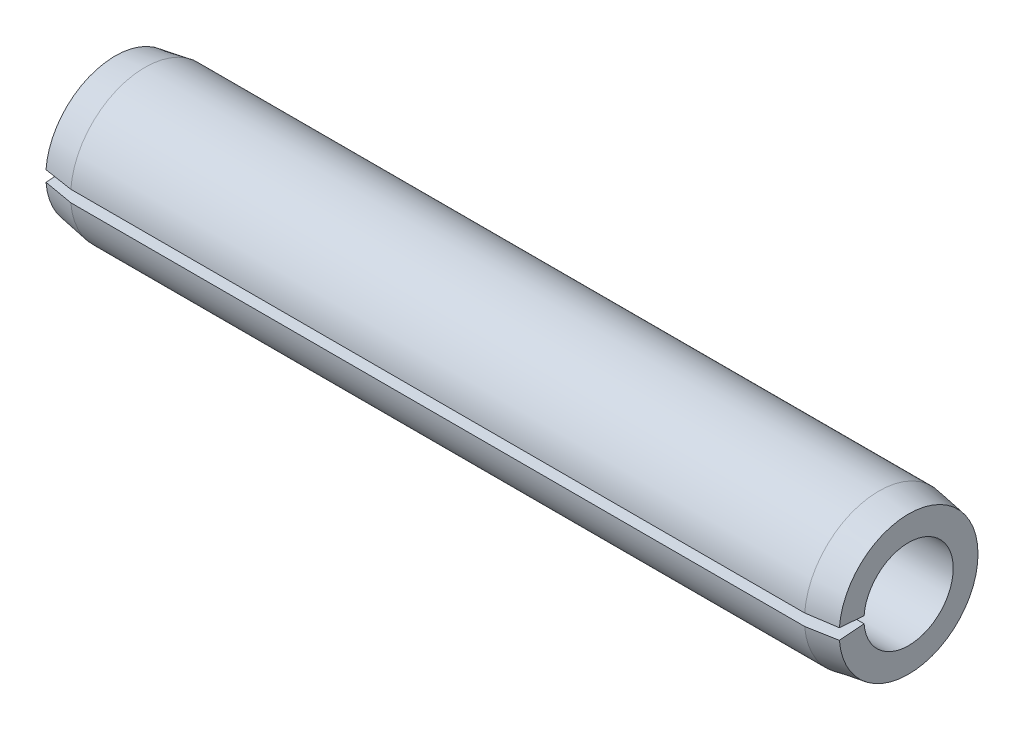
SolidWorks part; units mm, degrees
ref_plane "Plane1" through (0, 0, 0) normal (0, 0, 1) x (1, 0, 0)
ref_plane "Plane2" through (0, 0, 0) normal (0, 1, 0) x (1, 0, 0)
ref_plane "Plane3" through (0, 0, 0) normal (1, 0, 0) x (0, 0, -1)
sketch "Sketch1" plane through (0, 0, 0) normal (0, 0, 1) x (1, 0, 0)
  line L0 (-9.525, 0) -> (111.125, 0) construction
  line L1 (0, 5.715) -> (101.6, 5.715)
  line L2 (101.6, 5.715) -> (101.6, 8.89)
  line L3 (101.6, 8.89) -> (97.79, 9.525)
  line L4 (97.79, 9.525) -> (3.81, 9.525)
  line L5 (3.81, 9.525) -> (0, 8.89)
  line L7 (0, 8.89) -> (0, 5.715)
  dimension "Diameter" = 19.05
  dimension "Length" = 101.6
  dimension "Thickness" = 3.81
  dimension "Top_ch_len" = 3.81
  dimension "Bottom_ch_len" = 3.81
  dimension "Top_ch_dia" = 17.78
revolve "Base-Revolve" add sketch "Sketch1" angle 360 about L0
sketch "Sketch2" plane through (0, 0, 0) normal (-1, 0, 0) x (0, -1, 0)
  line L0 (0, 0) -> (0.7623, 9.6856)
  line L1 (0, -3.175) -> (0, 12.7) construction
  line L2 (0, 0) -> (-0.7623, 9.6856)
  arc A0 (0.7623, 9.6856) -> (-0.7623, 9.6856) centre (0, 0) ccw
  dimension "D1" = 9.7155
  dimension "Gap_ang" = 9
extrude "Gap" cut sketch "Sketch2" against normal through all
equation "\"D1@Sketch2\" = \"Diameter@Sketch1\" * 0.51"
equation "' \"Bottom_ch_dia@Sketch1\" = \"Diameter@Sketch1\" -  ( \"Thickness@Sketch1\" / 2 ) "
equation "' \"Top_ch_dia@Sketch1\" = \"Bottom_ch_dia@Sketch1\""
equation "' \"Top_ch_len@Sketch1\" = \"Bottom_ch_len@Sketch1\""
equation "\"Bottom_ch_len@Sketch1\" = \"Top_ch_len@Sketch1\""
